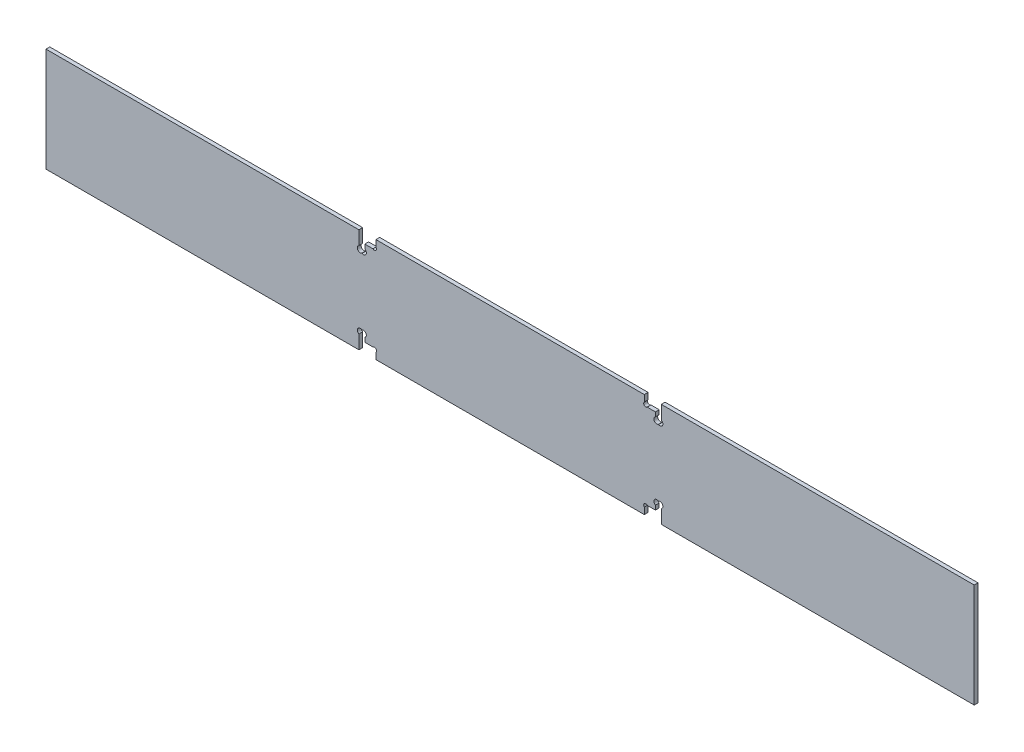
SolidWorks part; units mm, degrees
ref_plane "Plan de face" through (0, 0, 0) normal (0, 0, 1) x (1, 0, 0)
ref_plane "Plan de dessus" through (0, 0, 0) normal (0, 1, 0) x (1, 0, 0)
ref_plane "Plan de droite" through (0, 0, 0) normal (1, 0, 0) x (0, 0, -1)
sketch "Esquisse1" plane through (0, 0, 0) normal (0, 0, 1) x (1, 0, 0)
  line L0 (165.0142, -29.1918) -> (165.0142, 77.0872) construction
  line L1 (-0.5, 0) -> (165.0142, 0)
  line L2 (-0.5, 0) -> (-0.5, 55)
  line L3 (174.0142, 51.5698) -> (174.0142, 55)
  line L4 (490.5, 0) -> (490.5, 55)
  line L5 (168.1142, -21.648) -> (168.1142, 21.618) construction
  line L6 (174.0142, -5.8947) -> (174.0142, 10) construction
  line L7 (-10.9804, 27.5) -> (96.6243, 27.5) construction
  line L8 (245, 69.7653) -> (245, -12.9948) construction
  line L9 (157.8735, 5) -> (178.7846, 5) construction
  line L10 (178.7846, 10) -> (155.8498, 10) construction
  line L11 (168.1142, 11.3835) -> (168.1142, 1.2173) construction
  line L12 (166.4795, 10) -> (166.6488, 10)
  line L13 (174.0142, 5) -> (170.1332, 1.1191) construction
  line L14 (165.0142, 7.2689) -> (165.0142, 0)
  line L15 (168.1142, 7.2689) -> (168.1142, 5)
  line L16 (174.0142, 3.4302) -> (174.0142, 0)
  line L17 (166.5642, 12.6264) -> (166.5642, 6.8601) construction
  line L18 (168.1142, 5) -> (172.4444, 5)
  line L19 (174.0142, 0) -> (315.9858, 0)
  line L20 (165.0142, 47.7311) -> (165.0142, 55)
  line L21 (168.1142, 50) -> (172.4444, 50)
  line L22 (168.1142, 47.7311) -> (168.1142, 50)
  line L23 (166.4795, 45) -> (166.6488, 45)
  line L24 (174.0142, 55) -> (315.9858, 55)
  line L25 (324.9858, 7.2689) -> (324.9858, 0)
  line L26 (315.9858, 3.4302) -> (315.9858, 0)
  line L27 (321.8858, 5) -> (317.5556, 5)
  line L28 (324.9858, 47.7311) -> (324.9858, 55)
  line L29 (315.9858, 51.5698) -> (315.9858, 55)
  line L30 (323.5205, 45) -> (323.3512, 45)
  line L31 (321.8858, 47.7311) -> (321.8858, 50)
  line L32 (321.8858, 50) -> (317.5556, 50)
  line L33 (321.8858, 7.2689) -> (321.8858, 5)
  line L34 (323.5205, 10) -> (323.3512, 10)
  line L35 (324.9858, 0) -> (490.5, 0)
  line L36 (324.9858, 55) -> (490.5, 55)
  line L37 (-0.5, 55) -> (165.0142, 55)
  arc A0 (166.4795, 10) -> (165.0142, 7.2689) centre (165.7207, 8.6485) ccw
  arc A1 (166.6488, 10) -> (168.1142, 7.2689) centre (167.4076, 8.6485) cw
  arc A2 (174.0142, 3.4302) -> (172.4444, 5) centre (173.2293, 4.2151) ccw
  arc A3 (174.0142, 51.5698) -> (172.4444, 50) centre (173.2293, 50.7849) cw
  arc A4 (166.6488, 45) -> (168.1142, 47.7311) centre (167.4076, 46.3515) ccw
  arc A5 (166.4795, 45) -> (165.0142, 47.7311) centre (165.7207, 46.3515) cw
  arc A6 (315.9858, 3.4302) -> (317.5556, 5) centre (316.7707, 4.2151) cw
  arc A7 (323.5205, 45) -> (324.9858, 47.7311) centre (324.2793, 46.3515) ccw
  arc A8 (323.3512, 45) -> (321.8858, 47.7311) centre (322.5924, 46.3515) cw
  arc A9 (315.9858, 51.5698) -> (317.5556, 50) centre (316.7707, 50.7849) ccw
  arc A10 (323.3512, 10) -> (321.8858, 7.2689) centre (322.5924, 8.6485) ccw
  arc A11 (323.5205, 10) -> (324.9858, 7.2689) centre (324.2793, 8.6485) cw
  dimension "D7" = 45
  dimension "D1" = 1.55
  dimension "D2" = 9
  dimension "D3" = 10
  dimension "D4" = 5
  dimension "D5" = 3.1
extrude "Extrusion1" add sketch "Esquisse1" along normal blind 2
